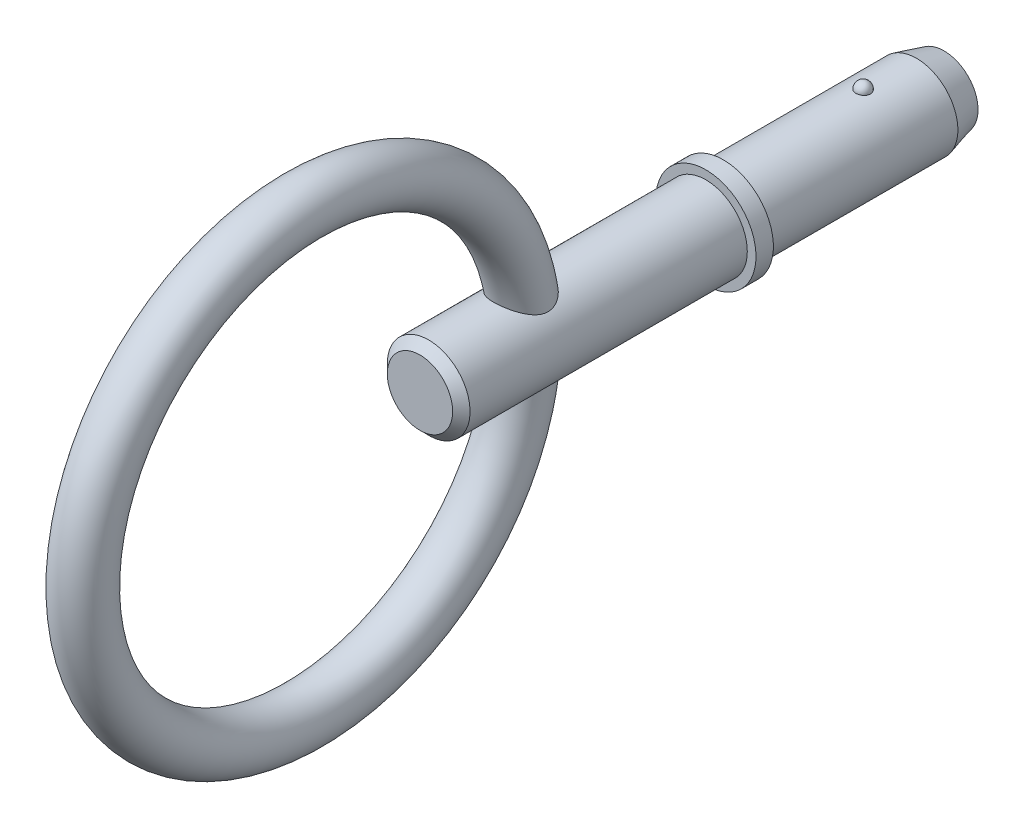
SolidWorks part; units mm, degrees
ref_plane "Front Plane" through (0, 0, 0) normal (0, 0, 1) x (1, 0, 0)
ref_plane "Top Plane" through (0, 0, 0) normal (0, 1, 0) x (1, 0, 0)
ref_plane "Right Plane" through (0, 0, 0) normal (1, 0, 0) x (0, 0, -1)
sketch "Sketch2" plane through (0, 0, 0) normal (0, 0, 1) x (1, 0, 0)
  circle A0 centre (0, 0) radius 2.38
  point P3 (0, 2.38)
  dimension "D1" = 4.76
extrude "Boss-Extrude1" add sketch "Sketch2" along normal blind 7.62
sketch "Sketch3" plane through (0, 0, 0) normal (0, 0, -1) x (-1, 0, 0)
  circle A0 centre (0, 0) radius 2.38
  dimension "D1" = 4.76
extrude "Boss-Extrude2" add sketch "Sketch3" along normal blind 5.08
chamfer "Chamfer1" distance 1.586 angle 15 1 edges at (-2.38, 0, -5.08)
sketch "Sketch18" plane through (0, 0, 0) normal (1, 0, 0) x (0, 0, -1)
  line L0 (3.494, 2.38) -> (-7.62, 2.38) construction
  line L1 (0.42, 2.8) -> (0.42, 1.96)
  line L2 (-7.62, -2.38) -> (3.494, -2.38) construction
  arc A0 (0.42, 2.8) -> (0.42, 1.96) centre (0.42, 2.38) ccw
  point P4 (0, 2.38)
  dimension "D1" = 5.18
revolve "Revolve1" add sketch "Sketch18" angle 360 about L1
sketch "Sketch19" plane through (0, 0, 0) normal (1, 0, 0) x (0, 0, -1)
  line L0 (-33.7288, 0) -> (-46.4542, 0) construction
sketch "Sketch20" plane through (0, 0, 0) normal (1, 0, 0) x (0, 0, -1)
  line L0 (-7.62, 0) -> (-7.62, 2.88)
  line L1 (-7.62, 2.38) -> (-7.62, -2.38) construction
  line L2 (-7.62, 2.88) -> (-8.62, 2.88)
  line L3 (-8.62, 2.88) -> (-8.62, 0)
  line L4 (-33.7288, 0) -> (-46.4542, 0) construction
  line L5 (-8.62, 0) -> (-7.62, 0)
  dimension "D1" = 2.88
  dimension "D2" = 1
revolve "Revolve2" add sketch "Sketch20" angle 360 about L0
sketch "Sketch21" plane through (0, 0, 7.62) normal (0, 0, -1) x (-1, 0, 0)
  circle A0 centre (0, 0) radius 2.38
  dimension "D1" = 4.76
extrude "Boss-Extrude3" add sketch "Sketch21" against normal blind 17.45
chamfer "Chamfer2" distance 0.5 angle 45 1 edges at (-2.38, 0, 25.07)
sketch "Sketch23" plane through (0, 0, 0) normal (1, 0, 0) x (0, 0, -1)
  line L0 (-25.07, 1.88) -> (-25.07, -1.88) construction
  circle A0 centre (-31.77, 0) radius 12.7
  point P2 (-19.07, 0)
  dimension "D1" = 25.4
  dimension "D2" = 6
sketch "Sketch24" plane through (0, 0, 0) normal (0, 1, 0) x (1, 0, 0)
  circle A0 centre (0, -19.07) radius 1.5
  dimension "D1" = 3
sweep "Sweep1" add profiles "Sketch24" path "Sketch23"
